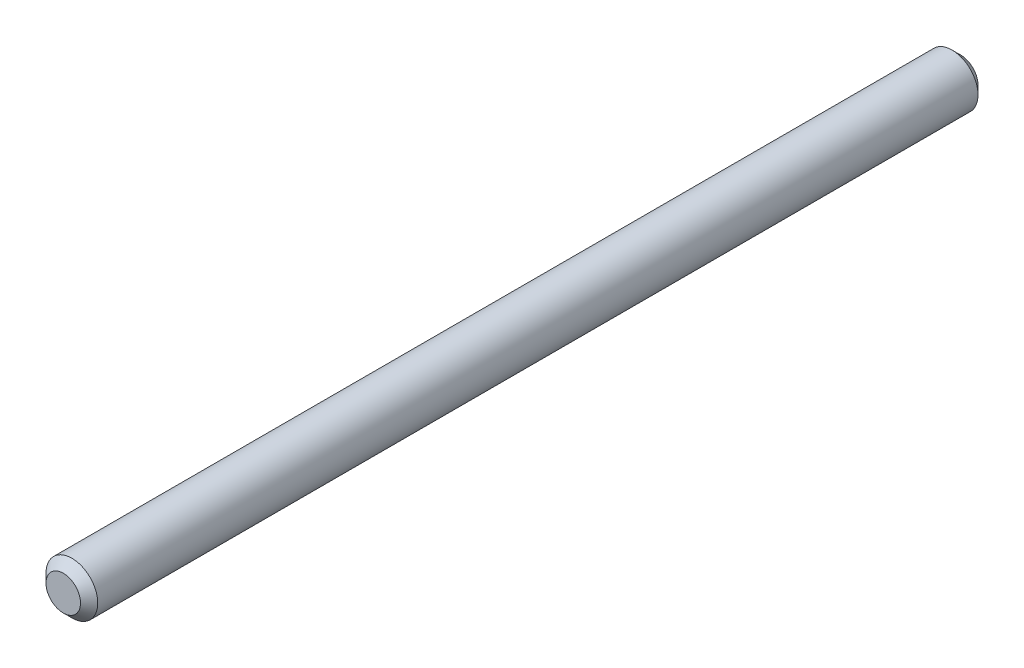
SolidWorks part; units mm, degrees
ref_plane "Plan1" through (0, 0, 0) normal (0, 0, 1) x (1, 0, 0)
ref_plane "Plan2" through (0, 0, 0) normal (0, 1, 0) x (1, 0, 0)
ref_plane "Plan3" through (0, 0, 0) normal (1, 0, 0) x (0, 0, -1)
sketch "Esquisse1" plane through (0, 0, 0) normal (0, 0, 1) x (1, 0, 0)
  circle A0 centre (0, 0) radius 1.5
  dimension "D1" = 3
extrude "Base-Extrusion" add sketch "Esquisse1" along normal blind 52
chamfer "Chanfrein1" distance 0.5 angle 45 2 edges at (1.5, 0, 0) (1.5, 0, 52)
